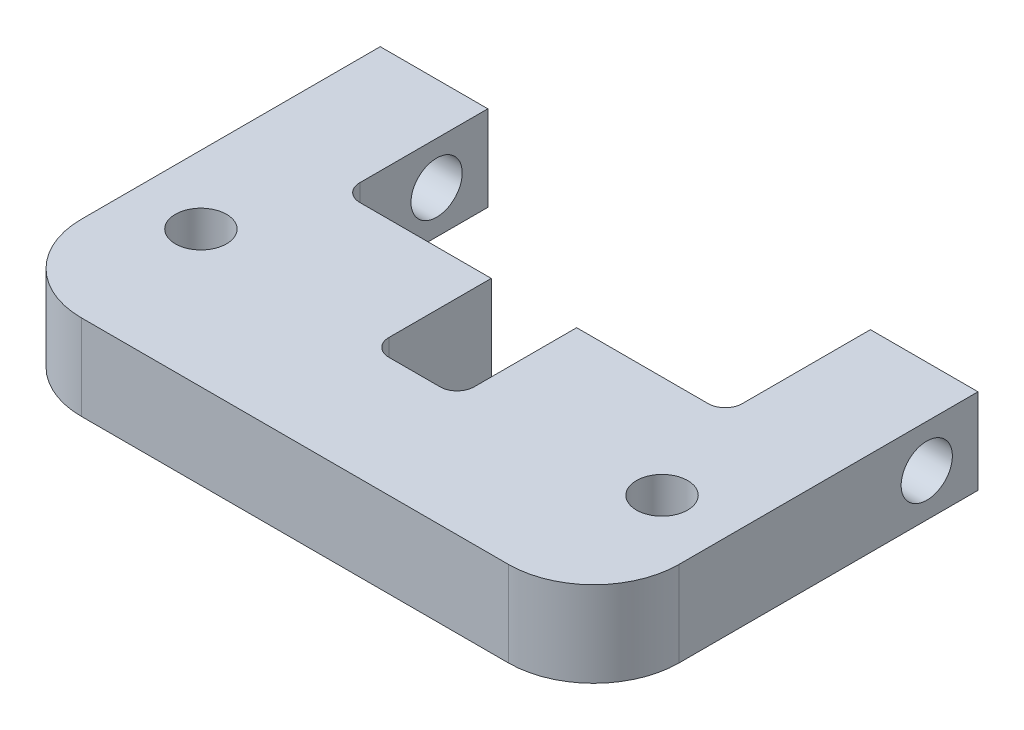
SolidWorks part; units mm, degrees
ref_plane "Ebene vorne" through (0, 0, 0) normal (0, 0, 1) x (1, 0, 0)
ref_plane "Ebene oben" through (0, 0, 0) normal (0, 1, 0) x (1, 0, 0)
ref_plane "Ebene rechts" through (0, 0, 0) normal (1, 0, 0) x (0, 0, -1)
sketch "Skizze1" plane through (0, 0, 0) normal (0, 1, 0) x (1, 0, 0)
  line L0 (0, 48.5029) -> (0, -41.1937) construction
  line L1 (11.2, 0) -> (17.5, 0)
  line L2 (-17.5, 0) -> (-11.2, 0)
  line L3 (-17.5, 0) -> (-17.5, -22.5)
  line L4 (-17.5, -22.5) -> (6, -22.5)
  line L5 (17.5, 0) -> (17.5, -22.5)
  line L6 (14.35, 0) -> (14.35, -22.5) construction
  line L7 (-11.2, 0) -> (-11.2, -7.5)
  line L8 (-10.2, -8.5) -> (-2.5, -8.5)
  line L9 (11.2, 0) -> (11.2, -7.5)
  line L10 (17.5, -14.5) -> (-17.5, -14.5) construction
  line L11 (2.5, -8.5) -> (10.2, -8.5)
  line L13 (-2.5, -8.5) -> (-2.5, -14.5)
  line L14 (-1.5, -15.5) -> (1.5, -15.5)
  line L15 (6, -22.5) -> (17.5, -22.5)
  line L16 (2.5, -8.5) -> (2.5, -14.5)
  circle A0 centre (13.5, -14.5) radius 1.5
  circle A1 centre (-13.5, -14.5) radius 1.5
  circle A2 centre (-13.5, -14.5) radius 3 construction
  circle A3 centre (13.5, -14.5) radius 3 construction
  arc A4 (11.2, -7.5) -> (10.2, -8.5) centre (10.2, -7.5) cw
  arc A5 (-11.2, -7.5) -> (-10.2, -8.5) centre (-10.2, -7.5) ccw
  arc A6 (2.5, -14.5) -> (1.5, -15.5) centre (1.5, -14.5) cw
  arc A7 (-2.5, -14.5) -> (-1.5, -15.5) centre (-1.5, -14.5) ccw
  point P23 (11.2, -8.5)
  point P27 (-11.2, -8.5)
  point P34 (2.5, -15.5)
  point P37 (-2.5, -15.5)
  dimension "D5" = 3
  dimension "D7" = 6
  dimension "D8" = 1
  dimension "D12" = 1
  dimension "D1" = 35
  dimension "D2" = 22.4
  dimension "D3" = 8.5
  dimension "D4" = 22.5
  dimension "D6" = 4
  dimension "D9" = 5
  dimension "D10" = 8
  dimension "D11" = 7
extrude "Aufsatz-Linear austragen4" add sketch "Skizze1" along normal blind 5
sketch "Skizze3" plane through (17.5, 0, 0) normal (1, 0, 0) x (0, 0, -1)
  line L0 (-3, 5) -> (-3, 0) construction
  line L1 (-22.5, 5) -> (0, 5) construction
  line L2 (-22.5, 0) -> (0, 0) construction
  line L3 (0, 5) -> (0, 0) construction
  circle A0 centre (-3, 2.5) radius 1.5
  dimension "D2" = 3
  dimension "D1" = 3
extrude "Schnitt-Linear austragen2" cut sketch "Skizze3" against normal through all
fillet "Verrundung1" radius 5 2 edges at (17.5, 2.5, 22.5) (-17.5, 2.5, 22.5)
